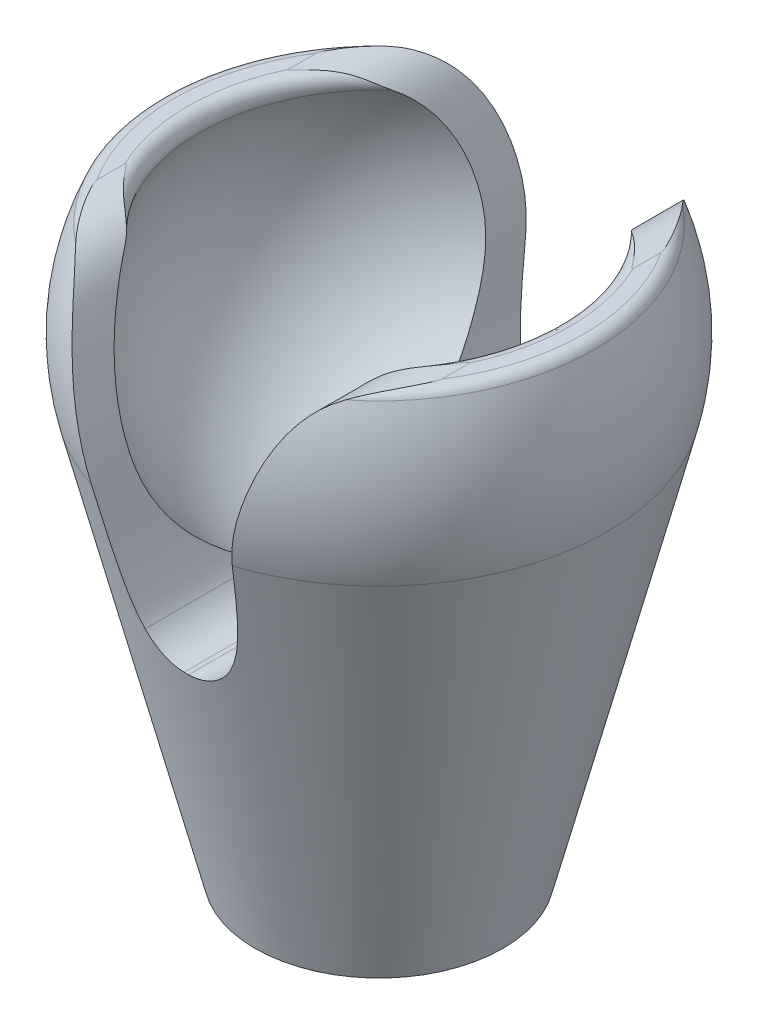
SolidWorks part; units mm, degrees
ref_plane "Front Plane" through (0, 0, 0) normal (0, 0, 1) x (1, 0, 0)
ref_plane "Top Plane" through (0, 0, 0) normal (0, 1, 0) x (1, 0, 0)
ref_plane "Right Plane" through (0, 0, 0) normal (1, 0, 0) x (0, 0, -1)
sketch "Sketch1" plane through (0, 0, 0) normal (0, 0, 1) x (1, 0, 0)
  line L0 (7.7031, 4.0933) -> (8.2516, 4.0933)
  line L1 (0, -8) -> (0, -19)
  line L2 (0, -19) -> (5, -19)
  line L3 (5, -19) -> (9.2108, -2.3261)
  arc A0 (7.25, 3.3819) -> (0, -8) centre (0, 0) cw
  arc A1 (8.71, 3.7929) -> (9.2108, -2.3261) centre (0, 0) cw
  arc A2 (8.71, 3.7929) -> (8.2516, 4.0933) centre (8.2516, 3.5933) ccw
  arc A3 (7.25, 3.3819) -> (7.7031, 4.0933) centre (7.7031, 3.5933) cw
  point P12 (6.8735, 4.0933)
  dimension "D1" = 8
  dimension "D2" = 9.5
  dimension "D6" = 0.5
  dimension "D3" = 5
  dimension "D4" = 11
  dimension "D5" = 7.25
revolve "Revolve1" add sketch "Sketch1" angle 360 about L1
sketch "Sketch2" plane through (0, -19, 0) normal (0, -1, 0) x (1, 0, 0)
  circle A0 centre (0, 0) radius 1.4
  dimension "D1" = 2.8
extrude "Cut-Extrude1" cut sketch "Sketch2" against normal blind 5
sketch "Sketch3" plane through (0, 0, 0) normal (0, 0, 1) x (1, 0, 0)
  line L1 (8.2516, 4.0933) -> (-8.2516, 4.0933) construction
  line L2 (6.9603, 4.0933) -> (-6.9603, 4.0933)
  line L3 (7.7031, 4.0933) -> (-7.7031, 4.0933) construction
  line L4 (0, 4.0933) -> (0, -8) construction
  arc A0 (-0.0897, -7.9995) -> (0.0897, -7.9995) centre (0, 0) ccw
  arc A2 (0.0897, -7.9995) -> (1.6344, -7.2423) centre (0.0673, -5.9996) ccw
  arc A3 (-0.0897, -7.9995) -> (-1.6344, -7.2423) centre (-0.0673, -5.9996) cw
  spline S0 degree 3 poles (1.6344, -7.2423) (2.1651, -6.573) (2.9262, -2.8974) (2.69, -1.6307) (4.5291, 3.6513) (5.9626, 4.0516) (6.9603, 4.0933) knots 0.060573 0.060573 0.060573 0.060573 0.234431 0.681567 0.853392 1 1 1 1
  spline S1 degree 3 poles (-1.6344, -7.2423) (-2.1651, -6.573) (-2.9262, -2.8974) (-2.69, -1.6307) (-4.5291, 3.6513) (-5.9626, 4.0516) (-6.9603, 4.0933) knots 0.060573 0.060573 0.060573 0.060573 0.234431 0.681567 0.853392 1 1 1 1
  dimension "D1" = 2
extrude "Cut-Extrude2" cut sketch "Sketch3" against normal mid plane 25
